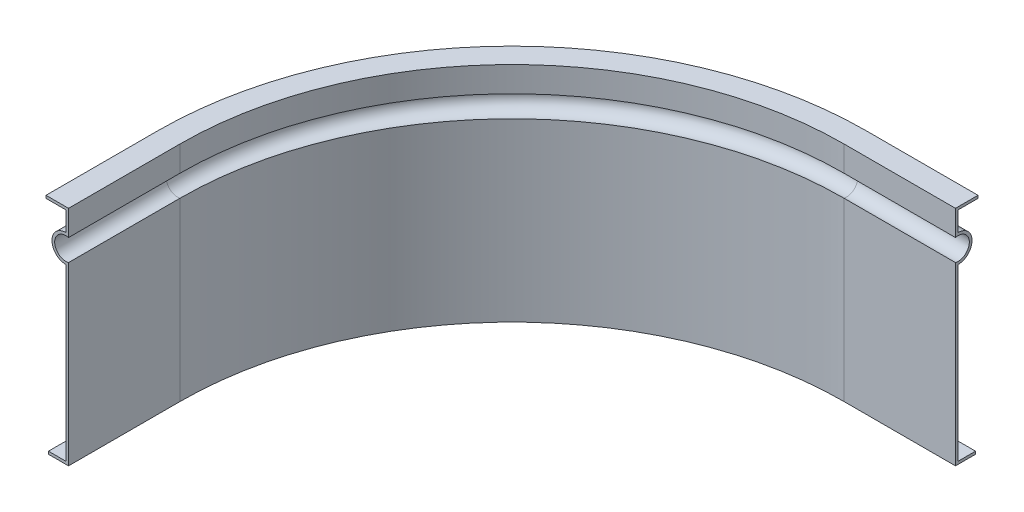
SolidWorks part; units mm, degrees
ref_plane "Front Plane" through (0, 0, 0) normal (0, 0, 1) x (1, 0, 0)
ref_plane "Top Plane" through (0, 0, 0) normal (0, 1, 0) x (1, 0, 0)
ref_plane "Right Plane" through (0, 0, 0) normal (1, 0, 0) x (0, 0, -1)
sketch "Sketch1" plane through (0, 0, 0) normal (0, 1, 0) x (1, 0, 0)
  line L0 (0, 0) -> (0, 50)
  line L1 (147.572, 197.572) -> (197.572, 197.572)
  line L2 (0, 0) -> (-47.572, 0) construction
  line L3 (-47.572, 0) -> (-47.572, 50) construction
  line L4 (147.572, 245.144) -> (197.572, 245.144) construction
  line L5 (197.572, 245.144) -> (197.572, 197.572) construction
  arc A0 (0, 50) -> (147.572, 197.572) centre (147.572, 50) cw
  arc A1 (-47.572, 50) -> (147.572, 245.144) centre (147.572, 50) cw construction
  dimension "D2" = 147.572
  dimension "D1" = 50
  dimension "D3" = 47.572
sketch "Sketch2" plane through (0, 0, 0) normal (0, 0, 1) x (1, 0, 0)
  line L0 (0, 0) -> (7.786, 0) construction
  line L1 (7.786, 0) -> (7.786, -1.214) construction
  line L2 (-10.214, -1.214) -> (-1.214, -1.214)
  line L3 (-1.214, 98.786) -> (-1.214, 87.4224)
  line L4 (-1.214, -1.214) -> (7.786, -1.214) construction
  line L5 (8.8901, 98.786) -> (8.8901, 97.572) construction
  line L6 (8.8901, 97.572) -> (0, 97.572) construction
  line L7 (-1.214, 77.7216) -> (-1.214, -1.214)
  line L8 (0, 97.572) -> (0, 88.786) construction
  line L9 (0, 76.358) -> (0, 0) construction
  line L10 (-2.428, 76.358) -> (-2.428, 0)
  line L11 (-2.428, 97.572) -> (-2.428, 88.786)
  line L12 (-11.3181, 97.572) -> (-2.428, 97.572)
  line L13 (-11.3181, 98.786) -> (-11.3181, 97.572)
  line L14 (-10.214, 0) -> (-10.214, -1.214)
  line L15 (-2.428, 0) -> (-10.214, 0)
  line L16 (8.8901, 98.786) -> (-1.214, 98.786) construction
  line L17 (-1.214, 98.786) -> (-11.3181, 98.786)
  arc A0 (-1.214, 87.4224) -> (-1.214, 77.7216) centre (0, 82.572) cw construction
  arc A1 (0, 88.786) -> (0, 76.358) centre (0, 82.572) cw construction
  arc A2 (-2.428, 88.786) -> (-2.428, 76.358) centre (-2.428, 82.572) ccw
  arc A3 (-1.214, 87.4224) -> (-1.214, 77.7216) centre (-2.428, 82.572) ccw
  dimension "D5" = 5
  dimension "D8" = 1.214
  dimension "D1" = 9
  dimension "D2" = 1.214
  dimension "D3" = 100
  dimension "D4" = 15
  dimension "D6" = 1.214
sweep "Sweep1" add profiles "Sketch2" path "Sketch1"
